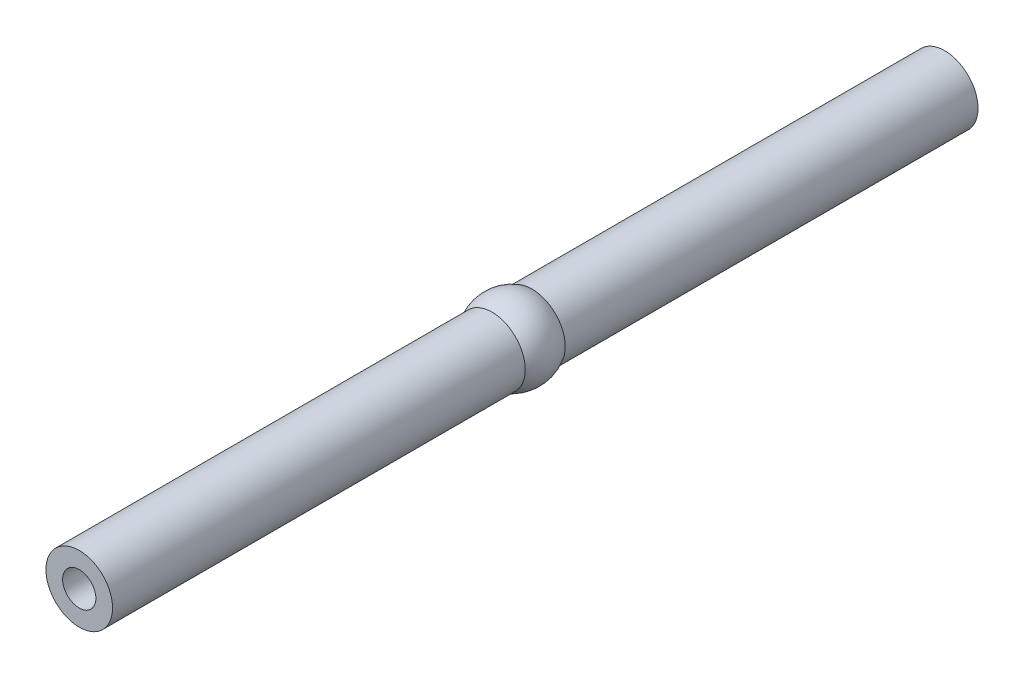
SolidWorks part; units mm, degrees
ref_plane "Face" through (0, 0, 0) normal (0, 0, 1) x (1, 0, 0)
ref_plane "Dessus" through (0, 0, 0) normal (0, 1, 0) x (1, 0, 0)
ref_plane "Droite" through (0, 0, 0) normal (1, 0, 0) x (0, 0, -1)
sketch "Esquisse1" plane through (0, 0, 0) normal (0, 0, 1) x (1, 0, 0)
  circle A0 centre (0, 0) radius 3
  dimension "D1" = 6
extrude "Extrusion1" add sketch "Esquisse1" along normal mid plane 78
sketch "Esquisse2" plane through (0, 0, 39) normal (0, 0, 1) x (1, 0, 0)
  circle A0 centre (0, 0) radius 1.5
  dimension "D1" = 3
extrude "Enlèv. mat.-Extru.1" cut sketch "Esquisse2" against normal blind 10
mirror "Symétrie1" about plane through (0, 0, 0) normal (0, 0, 1)
sketch "Esquisse3" plane through (0, 0, 0) normal (0, 1, 0) x (1, 0, 0)
  line L0 (0, 41.0191) -> (0, -19.8442) construction
  line L1 (0, 3.5) -> (0, -3.5)
  arc A0 (0, -3.5) -> (0, 3.5) centre (0, 0) ccw
  dimension "D1" = 7
revolve "Révolution1" add sketch "Esquisse3" angle 360 about L0
